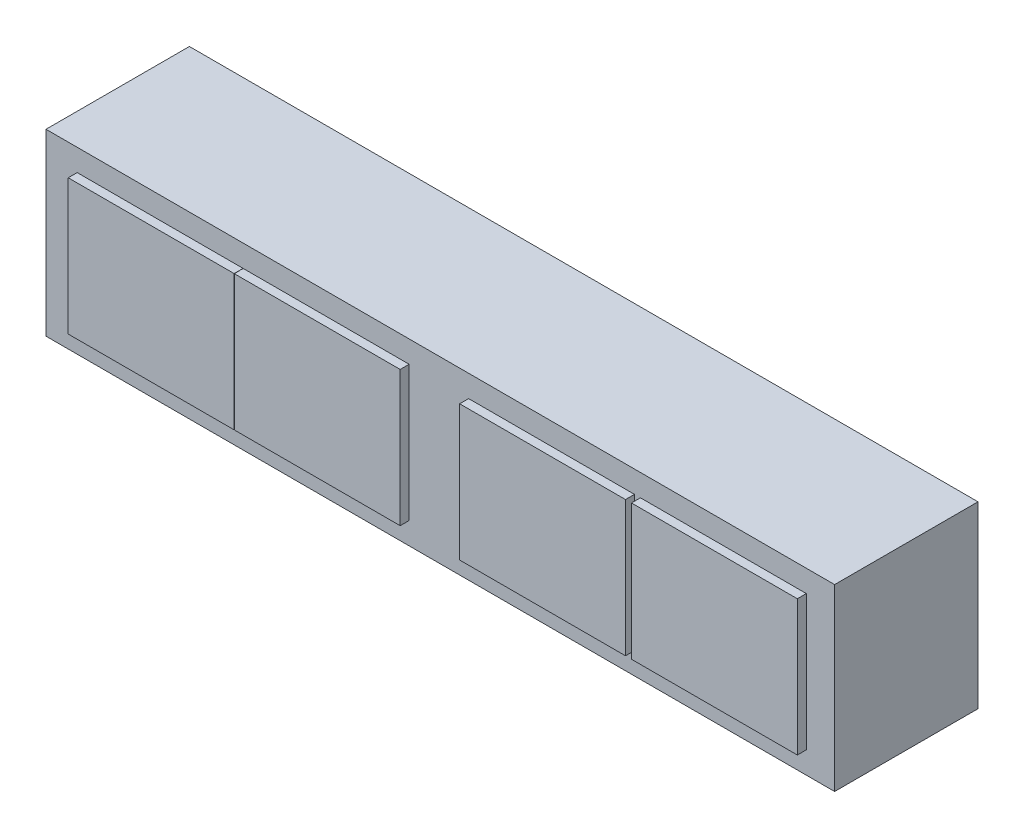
SolidWorks part; units mm, degrees
ref_plane "Front Plane" through (0, 0, 0) normal (0, 0, 1) x (1, 0, 0)
ref_plane "Top Plane" through (0, 0, 0) normal (0, 1, 0) x (1, 0, 0)
ref_plane "Right Plane" through (0, 0, 0) normal (1, 0, 0) x (0, 0, -1)
sketch "Sketch1" plane through (0, 0, 0) normal (0, 0, 1) x (1, 0, 0)
  line L1 (0, 0) -> (1676.4, 0)
  line L2 (0, 0) -> (0, 381)
  line L3 (0, 381) -> (1676.4, 381)
  line L4 (1676.4, 0) -> (1676.4, 381)
  dimension "D1" = 1676.4
  dimension "D2" = 381
extrude "Boss-Extrude1" add sketch "Sketch1" along normal blind 304.8
sketch "Sketch2" plane through (0, 0, 304.8) normal (0, 0, 1) x (1, 0, 0)
  line L0 (838.2, 381) -> (838.2, 0) construction
  line L1 (419.35, 334.3523) -> (771.9026, 334.3523)
  line L2 (419.35, 334.3523) -> (419.35, 46.6372)
  line L3 (419.35, 46.6372) -> (771.9026, 46.6372)
  line L4 (771.9026, 334.3523) -> (771.9026, 46.6372)
  line L5 (66.2974, 334.3523) -> (418.85, 334.3523)
  line L6 (66.2974, 334.3523) -> (66.2974, 46.6372)
  line L7 (66.2974, 46.6372) -> (418.85, 46.6372)
  line L8 (418.85, 334.3523) -> (418.85, 46.6372)
  line L9 (898.3974, 334.3523) -> (1250.95, 334.3523)
  line L10 (898.3974, 334.3523) -> (898.3974, 46.6372)
  line L11 (898.3974, 46.6372) -> (1250.95, 46.6372)
  line L12 (1250.95, 334.3523) -> (1250.95, 46.6372)
  line L13 (1263.65, 334.3523) -> (1616.2026, 334.3523)
  line L14 (1263.65, 334.3523) -> (1263.65, 46.6372)
  line L15 (1263.65, 46.6372) -> (1616.2026, 46.6372)
  line L16 (1616.2026, 334.3523) -> (1616.2026, 46.6372)
  line L17 (1676.4, 381) -> (0, 381) construction
  line L18 (0, 0) -> (1676.4, 0) construction
  line L19 (0, 381) -> (838.2, 381) construction
  line L20 (838.2, 381) -> (1676.4, 381) construction
  line L21 (419.1, 381) -> (419.1, 0) construction
  line L22 (1257.3, 381) -> (1257.3, 0) construction
  dimension "D1" = 0.25
  dimension "D2" = 6.35
extrude "Boss-Extrude2" add sketch "Sketch2" along normal blind 19.05
